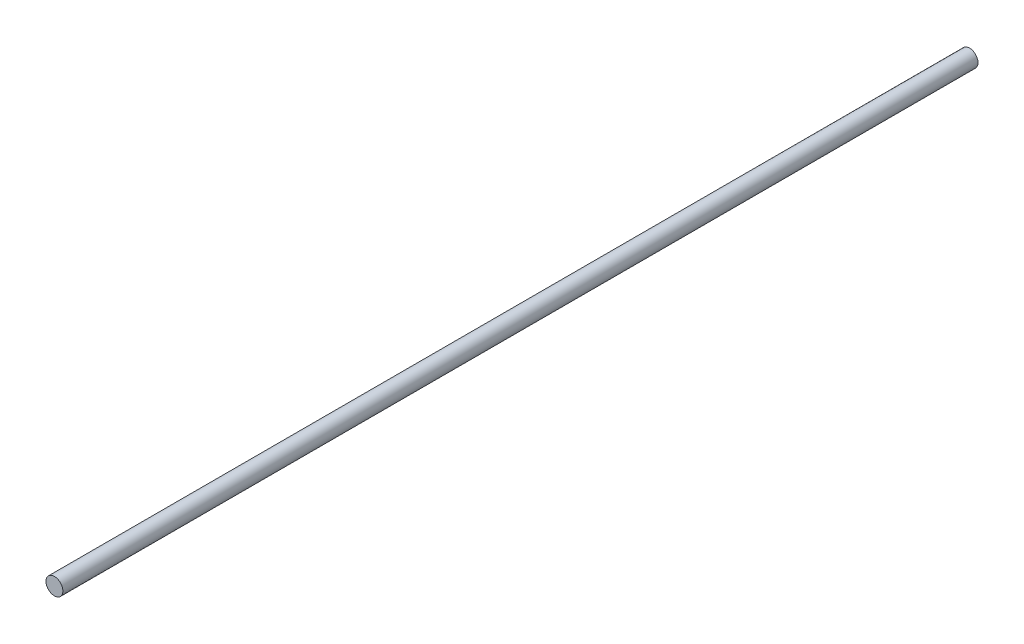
SolidWorks part; units mm, degrees
ref_plane "Front Plane" through (0, 0, 0) normal (0, 0, 1) x (1, 0, 0)
ref_plane "Top Plane" through (0, 0, 0) normal (0, 1, 0) x (1, 0, 0)
ref_plane "Right Plane" through (0, 0, 0) normal (1, 0, 0) x (0, 0, -1)
sketch "Sketch1" plane through (0, 0, 0) normal (0, 0, 1) x (1, 0, 0)
  circle A0 centre (0, 0) radius 30
  dimension "D1" = 60
extrude "Boss-Extrude1" add sketch "Sketch1" against normal blind 3250
